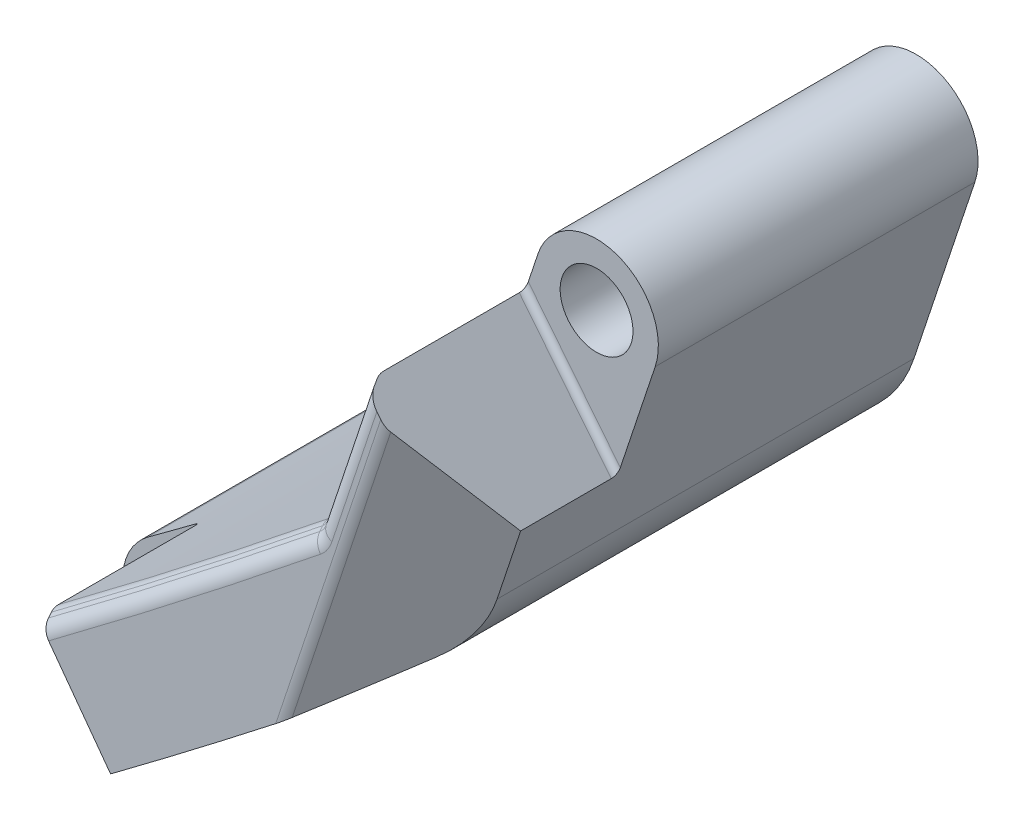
SolidWorks part; units mm, degrees
ref_plane "Front" through (0, 0, 0) normal (0, 0, 1) x (1, 0, 0)
ref_plane "Top" through (0, 0, 0) normal (0, 1, 0) x (1, 0, 0)
ref_plane "Right" through (0, 0, 0) normal (1, 0, 0) x (0, 0, -1)
ref_plane "Plane1"
sketch "Sketch1" plane through (0, 0, 0) normal (0, 0, 1) x (1, 0, 0)
  line L0 (-468.3145, -30.2474) -> (-473.0085, -44.3655)
  line L1 (-459.276, -33.2526) -> (-463.97, -47.3707)
  line L2 (-465.7556, -22.5511) -> (-473.0085, -44.3655) construction
  line L3 (-456.7171, -25.5562) -> (-463.97, -47.3707) construction
  line L4 (-471.7475, -24.0872) -> (-446.0632, -32.6267) construction
  line L26 (-467.185, -5.5063) -> (-467.1367, -5.4507)
  line L27 (-467.2376, -4.0174) -> (-470.3379, -1.325)
  line L28 (-456.1952, 20.2654) -> (-456.0091, 21.2739)
  line L29 (-432.2004, 59.493) -> (-432.0614, 60.5652)
  line L30 (-425.7905, 73.9476) -> (-426.2261, 76.596)
  line L31 (-428.913, 79.7432) -> (-431.1692, 80.4921)
  line L32 (-441.7414, 68.7387) -> (-442.3922, 68.2309)
  line L33 (-465.5868, 29.4112) -> (-466.2786, 28.9295)
  line L34 (-487.8267, -4.6121) -> (-489.9966, -8.5838)
  line L35 (-489.9966, -8.5838) -> (-492.579, -13.0808)
  line L36 (-492.579, -13.0808) -> (-498.4299, -23.7902)
  line L37 (-498.2502, -25.9811) -> (-490.4548, -35.9487)
  line L38 (-490.5046, -37.8868) -> (-494.3611, -42.3275)
  line L39 (-495.0911, -42.9478) -> (-501.2714, -46.7609)
  line L40 (-501.687, -50.0542) -> (-515.2956, -65.7245)
  line L41 (-515.0872, -67.5125) -> (-515.0302, -67.9839)
  line L42 (-518.6037, -71.0056) -> (-521.0991, -73.879)
  line L43 (-521.0234, -74.954) -> (-519.194, -76.5426)
  line L44 (-519.194, -76.5426) -> (-517.0322, -76.6445)
  line L45 (-513.3219, -74.806) -> (-509.4459, -72.1537)
  line L46 (-472.9409, -44.1622) -> (-467.0862, -26.553)
  line L47 (-479.9517, -15.9471) -> (-478.6314, -13.0808)
  line L48 (-478.6314, -13.0808) -> (-477.5788, -10.904)
  line L49 (-477.5788, -10.904) -> (-475.055, -5.5405)
  line L50 (-473.4927, -5.2075) -> (-470.5161, -7.7925)
  line L51 (-469.0828, -7.6916) -> (-469.0345, -7.636)
  line L52 (-467.185, -5.5063) -> (-467.1367, -5.4507) construction
  line L53 (-467.2376, -4.0174) -> (-470.3379, -1.325) construction
  line L54 (-456.1952, 20.2654) -> (-456.0091, 21.2739) construction
  line L55 (-432.2004, 59.493) -> (-432.0614, 60.5652) construction
  line L56 (-425.7905, 73.9476) -> (-426.2261, 76.596) construction
  line L57 (-428.913, 79.7432) -> (-431.1692, 80.4921) construction
  line L58 (-441.7414, 68.7387) -> (-442.3922, 68.2309) construction
  line L59 (-465.5868, 29.4112) -> (-466.2786, 28.9295) construction
  line L60 (-487.8267, -4.6121) -> (-489.9966, -8.5838) construction
  line L61 (-489.9966, -8.5838) -> (-492.579, -13.0808) construction
  line L62 (-492.579, -13.0808) -> (-498.4299, -23.7902) construction
  line L63 (-498.2502, -25.9811) -> (-490.4548, -35.9487) construction
  line L64 (-490.5046, -37.8868) -> (-494.3611, -42.3275) construction
  line L65 (-495.0911, -42.9478) -> (-501.2714, -46.7609) construction
  line L66 (-501.687, -50.0542) -> (-515.2956, -65.7245) construction
  line L67 (-515.0872, -67.5125) -> (-515.0302, -67.9839) construction
  line L68 (-518.6037, -71.0056) -> (-521.0991, -73.879) construction
  line L69 (-521.0234, -74.954) -> (-519.194, -76.5426) construction
  line L70 (-519.194, -76.5426) -> (-517.0322, -76.6445) construction
  line L71 (-513.3219, -74.806) -> (-509.4459, -72.1537) construction
  line L72 (-472.9409, -44.1622) -> (-467.0862, -26.553) construction
  line L73 (-479.9517, -15.9471) -> (-478.6314, -13.0808) construction
  line L74 (-478.6314, -13.0808) -> (-477.5788, -10.904) construction
  line L76 (-473.4927, -5.2075) -> (-470.5161, -7.7925) construction
  line L77 (-469.0828, -7.6916) -> (-469.0345, -7.636) construction
  line L84 (-459.359, 0) -> (-499.11, 0) construction
  line L136 (-477.5788, -10.904) -> (-475.055, -5.5405) construction
  arc A0 (-498.3894, -64.191) -> (-473.4161, -44.9532) centre (-912.9773, 499.8274) ccw
  arc A1 (-473.0085, -44.3655) -> (-473.4161, -44.9532) centre (-474.2136, -43.9648) cw
  arc A2 (-463.97, -47.3707) -> (-467.435, -52.3661) centre (-474.2136, -43.9648) cw
  arc A3 (-492.748, -71.8657) -> (-467.435, -52.3661) centre (-912.9773, 499.8274) ccw
  arc A4 (-459.276, -33.2526) -> (-468.3145, -30.2474) centre (-463.7952, -31.75) ccw
  arc A5 (-498.3894, -64.191) -> (-492.748, -71.8657) centre (-495.5687, -68.0284) ccw
  arc A6 (-529.6568, -97.2413) -> (-467.435, -52.3661) centre (-912.9773, 499.8274) ccw construction
  arc A7 (-534.8027, -89.226) -> (-473.4161, -44.9532) centre (-912.9773, 499.8274) ccw construction
  arc A54 (-469.0345, -7.636) -> (-468.6739, -6.8334) centre (-470.1852, -6.6367) ccw
  arc A55 (-469.0345, -7.636) -> (-468.6739, -6.8334) centre (-470.1852, -6.6367) ccw construction
  arc A56 (-467.1367, -5.4507) -> (-467.2376, -4.0174) centre (-467.9038, -4.7845) ccw
  arc A57 (-470.5052, -0.0019) -> (-470.3379, -1.325) centre (-469.6822, -0.57) ccw
  arc A58 (-470.5052, -0.0019) -> (-458.0934, 18.4881) centre (-1176.9045, 487.596) ccw
  arc A59 (-458.0934, 18.4881) -> (-457.85, 19.4364) centre (-459.3696, 19.321) ccw
  arc A60 (-456.1952, 20.2654) -> (-457.85, 19.4364) centre (-456.8529, 19.5121) ccw
  arc A61 (-455.5732, 22.3726) -> (-456.0091, 21.2739) centre (-453.0117, 20.7206) ccw
  arc A62 (-455.5732, 22.3726) -> (-434.0214, 57.6234) centre (-1176.9045, 487.596) ccw
  arc A63 (-434.0214, 57.6234) -> (-433.83, 58.5901) centre (-435.3404, 58.3868) ccw
  arc A64 (-432.2004, 59.493) -> (-433.83, 58.5901) centre (-432.839, 58.7234) ccw
  arc A65 (-431.685, 61.6856) -> (-432.0614, 60.5652) centre (-429.0387, 60.1732) ccw
  arc A66 (-431.685, 61.6856) -> (-426.2393, 71.3587) centre (-1176.9045, 487.596) ccw
  arc A67 (-426.2393, 71.3587) -> (-425.7905, 73.9476) centre (-429.7375, 73.2984) ccw
  arc A68 (-426.2261, 76.596) -> (-428.913, 79.7432) centre (-430.1731, 75.9469) ccw
  arc A69 (-431.1692, 80.4921) -> (-435.9313, 78.6287) centre (-432.4293, 76.6958) ccw
  arc A70 (-440.9661, 69.6365) -> (-435.9313, 78.6287) centre (-1176.9045, 487.596) ccw
  arc A71 (-441.7414, 68.7387) -> (-440.9661, 69.6365) centre (-443.6165, 71.1417) ccw
  arc A72 (-442.3899, 66.32) -> (-442.3922, 68.2309) centre (-442.6863, 67.2751) ccw
  arc A73 (-442.3899, 66.32) -> (-443.2592, 65.6244) centre (-441.9381, 64.8645) ccw
  arc A74 (-464.7639, 30.2655) -> (-443.2592, 65.6244) centre (-1176.9045, 487.596) ccw
  arc A75 (-465.5868, 29.4112) -> (-464.7639, 30.2655) centre (-467.3285, 31.9125) ccw
  arc A76 (-466.3709, 27.0156) -> (-466.2786, 28.9295) centre (-466.611, 27.9863) ccw
  arc A77 (-466.3709, 27.0156) -> (-467.2827, 26.3667) centre (-466.0049, 25.5362) ccw
  arc A78 (-478.1858, 10.0107) -> (-467.2827, 26.3667) centre (-1176.9045, 487.596) ccw
  arc A79 (-478.1858, 10.0107) -> (-481.4091, 4.5472) centre (-433.8251, -19.8428) ccw
  arc A80 (-467.185, -5.5063) -> (-468.6739, -6.8334) centre (-467.1627, -7.0301) ccw
  arc A81 (-467.185, -5.5063) -> (-468.6739, -6.8334) centre (-467.1627, -7.0301) ccw construction
  arc A82 (-482.6281, 2.0061) -> (-482.8335, 1.5414) centre (-433.8251, -19.8428) ccw
  arc A83 (-483.4172, 1.1898) -> (-482.8335, 1.5414) centre (-483.373, 1.7768) ccw
  arc A84 (-483.4172, 1.1898) -> (-484.3046, 0.9984) centre (-483.5374, -0.4056) ccw
  arc A85 (-484.3046, 0.9984) -> (-484.6707, 0.6547) centre (-483.8251, 0.1209) ccw
  arc A86 (-484.6707, 0.6547) -> (-486.9383, -3.0725) centre (-372.8092, -69.9538) ccw
  arc A87 (-486.9383, -3.0725) -> (-487.3917, -3.8375) centre (-454.3881, -22.8808) ccw
  arc A88 (-487.3917, -3.8375) -> (-487.8267, -4.6121) centre (-405.3022, -50.4461) ccw
  arc A89 (-498.4299, -23.7902) -> (-498.2502, -25.9811) centre (-496.6747, -24.7491) ccw
  arc A90 (-490.5046, -37.8868) -> (-490.4548, -35.9487) centre (-491.6553, -36.8875) ccw
  arc A91 (-495.0911, -42.9478) -> (-494.3611, -42.3275) centre (-496.7583, -40.2457) ccw
  arc A92 (-501.2714, -46.7609) -> (-501.5778, -48.1973) centre (-500.738, -47.6256) ccw
  arc A93 (-501.687, -50.0542) -> (-501.5778, -48.1973) centre (-502.8376, -49.0549) ccw
  arc A94 (-515.2956, -65.7245) -> (-515.3857, -66.5953) centre (-514.7202, -66.2241) ccw
  arc A95 (-515.0872, -67.5125) -> (-515.3857, -66.5953) centre (-517.5691, -67.813) ccw
  arc A96 (-517.9078, -70.7528) -> (-515.0302, -67.9839) centre (-517.5121, -68.2843) ccw
  arc A97 (-517.9078, -70.7528) -> (-518.6037, -71.0056) centre (-518.0284, -71.5052) ccw
  arc A98 (-521.0991, -73.879) -> (-521.0234, -74.954) centre (-520.5237, -74.3786) ccw
  arc A99 (-517.0322, -76.6445) -> (-515.1192, -76.0817) centre (-516.8887, -73.5999) ccw
  arc A100 (-513.3219, -74.806) -> (-515.1192, -76.0817) centre (-214.4421, -497.8086) ccw
  arc A101 (-509.4459, -72.1537) -> (-473.5833, -45.0881) centre (-912.9773, 499.8274) ccw
  arc A102 (-473.5833, -45.0881) -> (-472.9409, -44.1622) centre (-474.8387, -43.5312) ccw
  arc A103 (-467.0862, -26.553) -> (-472.8569, -21.1528) centre (-471.214, -25.1806) ccw
  arc A104 (-479.8788, -18.602) -> (-472.8569, -21.1528) centre (-474.9589, -15.999) ccw
  arc A105 (-479.9517, -15.9471) -> (-479.8788, -18.602) centre (-477.2303, -17.2007) ccw
  arc A106 (-473.4927, -5.2075) -> (-475.055, -5.5405) centre (-474.1484, -5.9625) ccw
  arc A107 (-470.5161, -7.7925) -> (-469.0828, -7.6916) centre (-469.8499, -7.0254) ccw
  arc A110 (-467.1367, -5.4507) -> (-467.2376, -4.0174) centre (-467.9038, -4.7845) ccw construction
  arc A111 (-470.5052, -0.0019) -> (-470.3379, -1.325) centre (-469.6822, -0.57) ccw construction
  arc A112 (-470.5052, -0.0019) -> (-458.0934, 18.4881) centre (-1176.9045, 487.596) ccw construction
  arc A113 (-458.0934, 18.4881) -> (-457.85, 19.4364) centre (-459.3696, 19.321) ccw construction
  arc A114 (-456.1952, 20.2654) -> (-457.85, 19.4364) centre (-456.8529, 19.5121) ccw construction
  arc A115 (-455.5732, 22.3726) -> (-456.0091, 21.2739) centre (-453.0117, 20.7206) ccw construction
  arc A116 (-455.5732, 22.3726) -> (-434.0214, 57.6234) centre (-1176.9045, 487.596) ccw construction
  arc A117 (-434.0214, 57.6234) -> (-433.83, 58.5901) centre (-435.3404, 58.3868) ccw construction
  arc A118 (-432.2004, 59.493) -> (-433.83, 58.5901) centre (-432.839, 58.7234) ccw construction
  arc A119 (-431.685, 61.6856) -> (-432.0614, 60.5652) centre (-429.0387, 60.1732) ccw construction
  arc A120 (-431.685, 61.6856) -> (-426.2393, 71.3587) centre (-1176.9045, 487.596) ccw construction
  arc A121 (-426.2393, 71.3587) -> (-425.7905, 73.9476) centre (-429.7375, 73.2984) ccw construction
  arc A122 (-426.2261, 76.596) -> (-428.913, 79.7432) centre (-430.1731, 75.9469) ccw construction
  arc A123 (-431.1692, 80.4921) -> (-435.9313, 78.6287) centre (-432.4293, 76.6958) ccw construction
  arc A124 (-440.9661, 69.6365) -> (-435.9313, 78.6287) centre (-1176.9045, 487.596) ccw construction
  arc A125 (-441.7414, 68.7387) -> (-440.9661, 69.6365) centre (-443.6165, 71.1417) ccw construction
  arc A126 (-442.3899, 66.32) -> (-442.3922, 68.2309) centre (-442.6863, 67.2751) ccw construction
  arc A127 (-442.3899, 66.32) -> (-443.2592, 65.6244) centre (-441.9381, 64.8645) ccw construction
  arc A128 (-464.7639, 30.2655) -> (-443.2592, 65.6244) centre (-1176.9045, 487.596) ccw construction
  arc A129 (-465.5868, 29.4112) -> (-464.7639, 30.2655) centre (-467.3285, 31.9125) ccw construction
  arc A130 (-466.3709, 27.0156) -> (-466.2786, 28.9295) centre (-466.611, 27.9863) ccw construction
  arc A131 (-466.3709, 27.0156) -> (-467.2827, 26.3667) centre (-466.0049, 25.5362) ccw construction
  arc A132 (-478.1858, 10.0107) -> (-467.2827, 26.3667) centre (-1176.9045, 487.596) ccw construction
  arc A133 (-478.1858, 10.0107) -> (-481.4091, 4.5472) centre (-433.8251, -19.8428) ccw construction
  arc A136 (-482.6281, 2.0061) -> (-482.8335, 1.5414) centre (-433.8251, -19.8428) ccw construction
  arc A137 (-483.4172, 1.1898) -> (-482.8335, 1.5414) centre (-483.373, 1.7768) ccw construction
  arc A138 (-483.4172, 1.1898) -> (-484.3046, 0.9984) centre (-483.5374, -0.4056) ccw construction
  arc A139 (-484.3046, 0.9984) -> (-484.6707, 0.6547) centre (-483.8251, 0.1209) ccw construction
  arc A140 (-484.6707, 0.6547) -> (-486.9383, -3.0725) centre (-372.8092, -69.9538) ccw construction
  arc A141 (-486.9383, -3.0725) -> (-487.3917, -3.8375) centre (-454.3881, -22.8808) ccw construction
  arc A142 (-487.3917, -3.8375) -> (-487.8267, -4.6121) centre (-405.3022, -50.4461) ccw construction
  arc A143 (-498.4299, -23.7902) -> (-498.2502, -25.9811) centre (-496.6747, -24.7491) ccw construction
  arc A144 (-490.5046, -37.8868) -> (-490.4548, -35.9487) centre (-491.6553, -36.8875) ccw construction
  arc A145 (-495.0911, -42.9478) -> (-494.3611, -42.3275) centre (-496.7583, -40.2457) ccw construction
  arc A146 (-501.2714, -46.7609) -> (-501.5778, -48.1973) centre (-500.738, -47.6256) ccw construction
  arc A147 (-501.687, -50.0542) -> (-501.5778, -48.1973) centre (-502.8376, -49.0549) ccw construction
  arc A148 (-515.2956, -65.7245) -> (-515.3857, -66.5953) centre (-514.7202, -66.2241) ccw construction
  arc A149 (-515.0872, -67.5125) -> (-515.3857, -66.5953) centre (-517.5691, -67.813) ccw construction
  arc A150 (-517.9078, -70.7528) -> (-515.0302, -67.9839) centre (-517.5121, -68.2843) ccw construction
  arc A151 (-517.9078, -70.7528) -> (-518.6037, -71.0056) centre (-518.0284, -71.5052) ccw construction
  arc A152 (-521.0991, -73.879) -> (-521.0234, -74.954) centre (-520.5237, -74.3786) ccw construction
  arc A154 (-513.3219, -74.806) -> (-515.1192, -76.0817) centre (-214.4421, -497.8086) ccw construction
  arc A155 (-509.4459, -72.1537) -> (-473.5833, -45.0881) centre (-912.9773, 499.8274) ccw construction
  arc A156 (-473.5833, -45.0881) -> (-472.9409, -44.1622) centre (-474.8387, -43.5312) ccw construction
  arc A157 (-467.0862, -26.553) -> (-472.8569, -21.1528) centre (-471.214, -25.1806) ccw construction
  arc A158 (-479.8788, -18.602) -> (-472.8569, -21.1528) centre (-474.9589, -15.999) ccw construction
  arc A159 (-479.9517, -15.9471) -> (-479.8788, -18.602) centre (-477.2303, -17.2007) ccw construction
  arc A160 (-473.4927, -5.2075) -> (-475.055, -5.5405) centre (-474.1484, -5.9625) ccw construction
  arc A161 (-470.5161, -7.7925) -> (-469.0828, -7.6916) centre (-469.8499, -7.0254) ccw construction
  arc A278 (-482.0313, 2.6841) -> (-481.4091, 4.5472) centre (-482.8255, 3.9848) ccw
  arc A279 (-482.0313, 2.6841) -> (-481.4091, 4.5472) centre (-482.8255, 3.9848) ccw construction
  arc A280 (-482.0313, 2.6841) -> (-482.6281, 2.0061) centre (-481.2371, 1.3833) ccw
  arc A281 (-482.0313, 2.6841) -> (-482.6281, 2.0061) centre (-481.2371, 1.3833) ccw construction
  arc A282 (-517.0322, -76.6445) -> (-515.1192, -76.0817) centre (-516.8887, -73.5999) ccw construction
extrude "Boss-Extrude1" add sketch "Sketch1" against normal blind 31.75 flip side to cut
hole_wizard "Hole1" positions "Point_Sketch" profile "Profil_Sketch" counterbore size "1/4" standard "ANSI Inch"
sketch "Point_Sketch" plane through (-506.2595, -65.4858, 0) normal (0, 0, -1) x (1, 0, 0)
  point P0 (10.6908, 2.5426)
  point P2 (42.4643, -33.7358)
sketch "Profil_Sketch" plane through (-495.5687, -68.0284, 0) normal (1, 0, 0) x (0, -1, 0)
  line L0 (0, 0) -> (0, 31.75)
  line L1 (0, 31.75) -> (2.8067, 31.75)
  line L3 (2.8067, 31.75) -> (2.8067, 7.112)
  line L4 (2.8067, 7.112) -> (4.5593, 7.112)
  line L5 (4.5593, 7.112) -> (4.5593, 0)
  line L7 (4.5593, 0) -> (0, 0)
  line L11 (0, -6.35) -> (0, 107.95) construction
  dimension "Diameter" = 5.6134
  dimension "Thru Hole Depth" = 31.75
  dimension "L1" = 7.112
other "usin_LS160_10-24x1.75-SHCS<1>"
sketch "Sketch4" plane through (0, 0, 0) normal (0, 0, 1) x (1, 0, 0)
  line L0 (-494.7246, -61.4787) -> (-489.0831, -69.1536)
  line L1 (-498.3894, -64.191) -> (-492.748, -71.8657) construction
  line L2 (-463.97, -47.3707) -> (-459.276, -33.2526)
  line L3 (-468.3145, -30.2474) -> (-473.0085, -44.3655)
  line L4 (-461.9639, -41.337) -> (-459.276, -33.2526)
  line L5 (-468.3145, -30.2474) -> (-469.0548, -32.4741)
  line L6 (-459.276, -33.2526) -> (-459.6557, -32.7779) construction
  line L7 (-461.9639, -41.337) -> (-469.0548, -32.4741)
  circle A0 centre (-495.5687, -68.0284) radius 4.5593 construction
  circle A1 centre (-463.7952, -31.75) radius 4.5593 construction
  arc A6 (-473.4161, -44.9532) -> (-473.0085, -44.3655) centre (-474.2136, -43.9648) ccw
  arc A7 (-498.3894, -64.191) -> (-473.4161, -44.9532) centre (-912.9773, 499.8274) ccw
  arc A8 (-498.3894, -64.191) -> (-492.748, -71.8657) centre (-495.5687, -68.0284) ccw
  arc A9 (-492.748, -71.8657) -> (-467.435, -52.3661) centre (-912.9773, 499.8274) ccw
  arc A10 (-467.435, -52.3661) -> (-463.97, -47.3707) centre (-474.2136, -43.9648) ccw
  arc A11 (-459.276, -33.2526) -> (-468.3145, -30.2474) centre (-463.7952, -31.75) ccw
  arc A13 (-498.3894, -64.191) -> (-494.7246, -61.4787) centre (-912.9773, 499.8274) ccw
  arc A14 (-498.3894, -64.191) -> (-492.748, -71.8657) centre (-495.5687, -68.0284) ccw
  arc A15 (-492.748, -71.8657) -> (-489.0831, -69.1536) centre (-912.9773, 499.8274) ccw
  arc A17 (-459.276, -33.2526) -> (-468.3145, -30.2474) centre (-463.7952, -31.75) ccw
  dimension "D1" = 0
extrude "Cut-Extrude1" cut sketch "Sketch4" against normal up to surface (7.112 mm away)
other "Move Face2" parameters "D1"=0.508
fillet "Fillet2" radius 0.508 2 edges at (-491.4966, -65.0125, -7.112) (-465.7004, -37.48, -7.112)
other "Move Face1" parameters "D1"=5.461
chamfer "Chamfer1" distance 1.27 angle 30 3 edges at (-483.7901, -53.1629, 5.461) (-473.1701, -44.6887, 5.461) (-471.1272, -38.707, 5.461)
chamfer "Chamfer2" distance 5.08 angle 55 1 edges at (-463.0624, -44.641, 5.461)
fillet "Fillet1" radius 1.27 7 edges at (-483.3426, -53.7438, 5.461) (-472.5676, -45.1066, 5.461) (-471.4657, -46.9203, 5.461) (-470.5063, -39.1638, 5.461) (-483.7901, -53.1629, 4.191) (-473.1701, -44.6887, 4.191) (-471.1272, -38.707, 4.191)
sketch "Sketch5" plane through (0, 0, -31.75) normal (0, 0, -1) x (-1, 0, 0)
  line L0 (499.9019, -101.4235) -> (434.5057, -51.0465)
  line L1 (499.9019, -101.4235) -> (527.028, -66.2102)
  line L2 (434.5057, -51.0465) -> (461.6318, -15.8332)
  line L3 (527.028, -66.2102) -> (461.6318, -15.8332)
  line L4 (492.748, -71.8657) -> (467.435, -52.3661) construction
  arc A1 (492.748, -71.8657) -> (498.3894, -64.191) centre (495.5687, -68.0284) ccw construction
  arc A4 (468.3145, -30.2474) -> (459.276, -33.2526) centre (463.7952, -31.75) ccw construction
  dimension "D1" = 19.05
  dimension "D2" = 19.05
  dimension "D3" = 82.55
  dimension "D4" = 44.45
  dimension "D5" = 6.5266
  dimension "D6" = 6.6648
